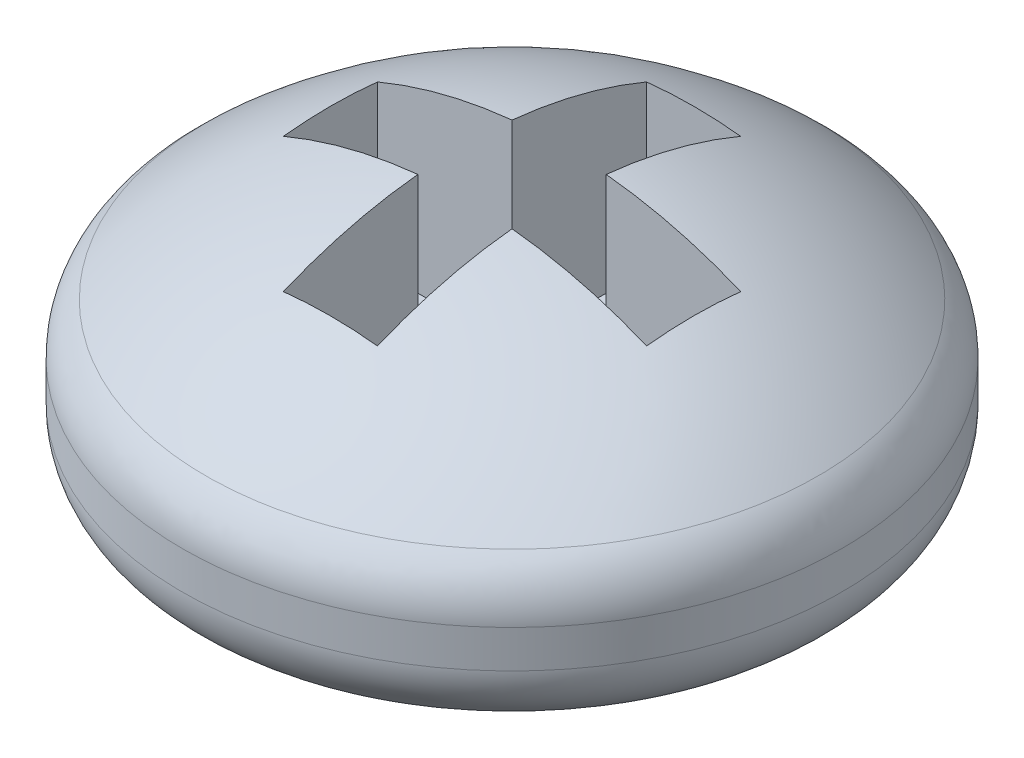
SolidWorks part; units mm, degrees
ref_plane "Front Plane" through (0, 0, 0) normal (0, 0, 1) x (1, 0, 0)
ref_plane "Top Plane" through (0, 0, 0) normal (0, 1, 0) x (1, 0, 0)
ref_plane "Right Plane" through (0, 0, 0) normal (1, 0, 0) x (0, 0, -1)
imported_body "Imported3"
sketch "Sketch1" plane through (0, 63.23, 0) normal (0, -1, 0) x (1, 0, 0)
  circle A0 centre (0, 0) radius 2.45
extrude "Boss-Extrude1" add sketch "Sketch1" along normal blind 1
imported_body "Surface-Imported1"
ref_plane "Plane1" through (0, 62.73, 0) normal (0, -1, 0) x (1, 0, 0)
sketch "Sketch2" plane through (0, 62.73, 0) normal (0, -1, 0) x (1, 0, 0)
  line L0 (-0.35, 1.35) -> (-0.35, 0.35)
  line L1 (-0.35, 0.35) -> (-1.35, 0.35)
  line L2 (-1.35, 0.35) -> (-1.35, -0.35)
  line L3 (-1.35, -0.35) -> (-0.35, -0.35)
  line L4 (-0.35, -0.35) -> (-0.35, -1.35)
  line L5 (-0.35, -1.35) -> (0.35, -1.35)
  line L6 (0.35, -1.35) -> (0.35, -0.35)
  line L7 (0.35, -0.35) -> (1.35, -0.35)
  line L8 (1.35, -0.35) -> (1.35, 0.35)
  line L9 (1.35, 0.35) -> (0.35, 0.35)
  line L10 (0.35, 0.35) -> (0.35, 1.35)
  line L11 (0.35, 1.35) -> (-0.35, 1.35)
extrude "Cut-Extrude1" cut sketch "Sketch2" against normal up to surface
fillet "Fillet1" radius 0.5 2 edges at (0, 62.23, -2.45) (0, 63.23, -2.45)
